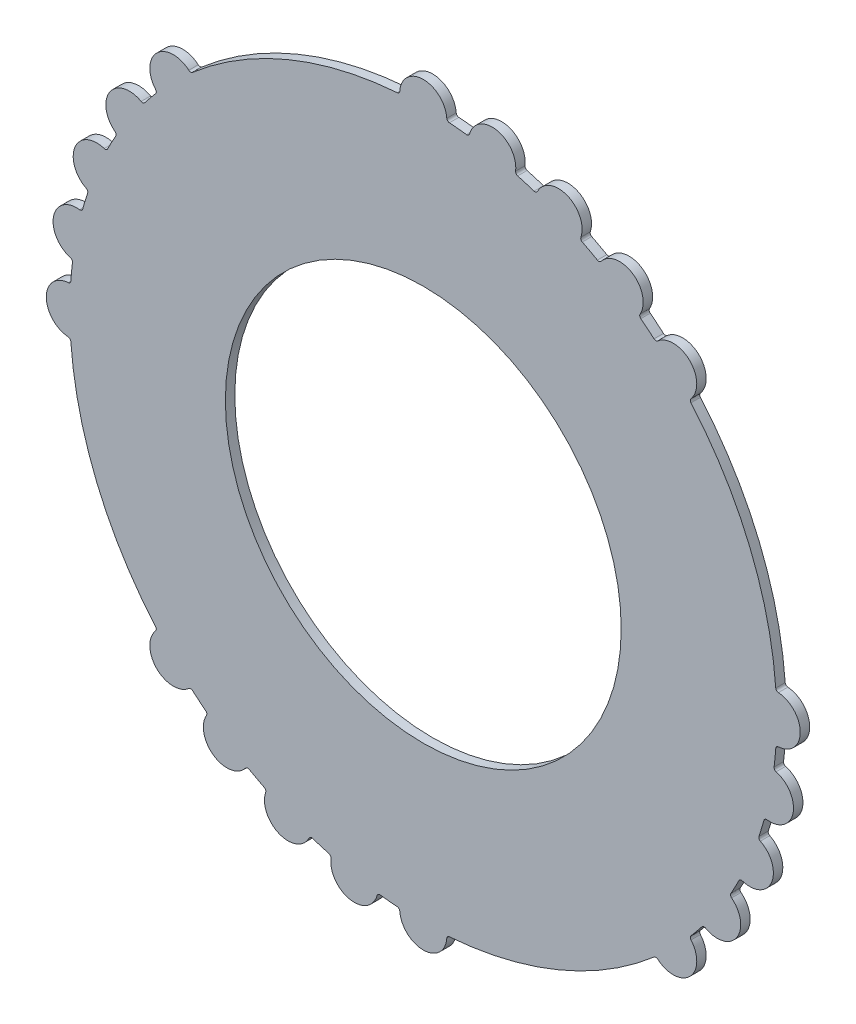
SolidWorks part; units mm, degrees
ref_plane "Plan de face" through (0, 0, 0) normal (0, 0, 1) x (1, 0, 0)
ref_plane "Plan de dessus" through (0, 0, 0) normal (0, 1, 0) x (1, 0, 0)
ref_plane "Plan de droite" through (0, 0, 0) normal (1, 0, 0) x (0, 0, -1)
sketch "Esquisse1" plane through (0, 0, 0) normal (0, 0, 1) x (1, 0, 0)
  line L0 (0, 37.5) -> (0, 0) construction
  line L1 (7.3159, 36.7794) -> (0, 0) construction
  line L2 (14.3506, 34.6455) -> (0, 0) construction
  line L3 (20.8339, 31.1801) -> (0, 0) construction
  line L4 (26.5165, 26.5165) -> (0, 0) construction
  line L5 (31.1801, 20.8339) -> (0, 0) construction
  line L6 (34.6455, 14.3506) -> (0, 0) construction
  line L7 (36.7794, 7.3159) -> (0, 0) construction
  line L8 (37.5, 0) -> (0, 0) construction
  line L9 (36.7794, -7.3159) -> (0, 0) construction
  line L10 (34.6455, -14.3506) -> (0, 0) construction
  line L11 (31.1801, -20.8339) -> (0, 0) construction
  line L12 (26.5165, -26.5165) -> (0, 0) construction
  line L13 (20.8339, -31.1801) -> (0, 0) construction
  line L14 (14.3506, -34.6455) -> (0, 0) construction
  line L15 (7.3159, -36.7794) -> (0, 0) construction
  line L16 (0, -37.5) -> (0, 0) construction
  line L17 (-7.3159, -36.7794) -> (0, 0) construction
  line L18 (-14.3506, -34.6455) -> (0, 0) construction
  line L19 (-20.8339, -31.1801) -> (0, 0) construction
  line L20 (-26.5165, -26.5165) -> (0, 0) construction
  line L21 (-31.1801, -20.8339) -> (0, 0) construction
  line L22 (-34.6455, -14.3506) -> (0, 0) construction
  line L23 (-36.7794, -7.3159) -> (0, 0) construction
  line L24 (-37.5, 0) -> (0, 0) construction
  line L25 (-36.7794, 7.3159) -> (0, 0) construction
  line L26 (-34.6455, 14.3506) -> (0, 0) construction
  line L27 (-31.1801, 20.8339) -> (0, 0) construction
  line L28 (-26.5165, 26.5165) -> (0, 0) construction
  line L29 (-20.8339, 31.1801) -> (0, 0) construction
  line L30 (-14.3506, 34.6455) -> (0, 0) construction
  line L31 (-7.3159, 36.7794) -> (0, 0) construction
  arc A0 (-2.7709, 37.3975) -> (-24.4847, 28.4034) centre (0, 0) ccw
  circle A1 centre (0, 0) radius 21
  arc A2 (2.4938, 37.6756) -> (-2.4938, 37.6756) centre (0, 37.5) ccw
  arc A3 (9.7961, 36.4651) -> (4.9042, 37.4382) centre (7.3159, 36.7794) ccw
  arc A4 (16.7218, 33.8534) -> (12.1138, 35.7621) centre (14.3506, 34.6455) ccw
  arc A5 (23.005, 29.9406) -> (18.8579, 32.7116) centre (20.8339, 31.1801) ccw
  arc A6 (28.4041, 24.8773) -> (24.8773, 28.4041) centre (26.5165, 26.5165) ccw
  arc A7 (32.4893, 18.7041) -> (29.7135, 22.8585) centre (31.1801, 20.8339) ccw
  arc A8 (35.514, 12.0064) -> (33.602, 16.6224) centre (34.6455, 14.3506) ccw
  arc A9 (37.174, 4.8472) -> (36.1992, 9.7476) centre (36.7794, 7.3159) ccw
  arc A10 (37.6756, -2.4938) -> (37.6756, 2.4938) centre (37.5, 0) ccw
  arc A11 (36.4651, -9.7961) -> (37.4382, -4.9042) centre (36.7794, -7.3159) ccw
  arc A12 (33.8534, -16.7218) -> (35.7621, -12.1138) centre (34.6455, -14.3506) ccw
  arc A13 (29.9406, -23.005) -> (32.7116, -18.8579) centre (31.1801, -20.8339) ccw
  arc A14 (24.8773, -28.4041) -> (28.4041, -24.8773) centre (26.5165, -26.5165) ccw
  arc A15 (18.7041, -32.4893) -> (22.8585, -29.7135) centre (20.8339, -31.1801) ccw
  arc A16 (12.0064, -35.514) -> (16.6224, -33.602) centre (14.3506, -34.6455) ccw
  arc A17 (4.8472, -37.174) -> (9.7476, -36.1992) centre (7.3159, -36.7794) ccw
  arc A18 (-2.4938, -37.6756) -> (2.4938, -37.6756) centre (0, -37.5) ccw
  arc A19 (-9.7961, -36.4651) -> (-4.9042, -37.4382) centre (-7.3159, -36.7794) ccw
  arc A20 (-16.7218, -33.8534) -> (-12.1138, -35.7621) centre (-14.3506, -34.6455) ccw
  arc A21 (-23.005, -29.9406) -> (-18.8579, -32.7116) centre (-20.8339, -31.1801) ccw
  arc A22 (-28.4041, -24.8773) -> (-24.8773, -28.4041) centre (-26.5165, -26.5165) ccw
  arc A23 (-32.4893, -18.7041) -> (-29.7135, -22.8585) centre (-31.1801, -20.8339) ccw
  arc A24 (-35.514, -12.0064) -> (-33.602, -16.6224) centre (-34.6455, -14.3506) ccw
  arc A25 (-37.174, -4.8472) -> (-36.1992, -9.7476) centre (-36.7794, -7.3159) ccw
  arc A26 (-37.6756, 2.4938) -> (-37.6756, -2.4938) centre (-37.5, 0) ccw
  arc A27 (-36.4651, 9.7961) -> (-37.4382, 4.9042) centre (-36.7794, 7.3159) ccw
  arc A28 (-33.8534, 16.7218) -> (-35.7621, 12.1138) centre (-34.6455, 14.3506) ccw
  arc A29 (-29.9406, 23.005) -> (-32.7116, 18.8579) centre (-31.1801, 20.8339) ccw
  arc A30 (-24.8773, 28.4041) -> (-28.4041, 24.8773) centre (-26.5165, 26.5165) ccw
  arc A31 (-18.7041, 32.4893) -> (-22.8585, 29.7135) centre (-20.8339, 31.1801) ccw
  arc A32 (-12.0064, 35.514) -> (-16.6224, 33.602) centre (-14.3506, 34.6455) ccw
  arc A33 (-4.8472, 37.174) -> (-9.7476, 36.1992) centre (-7.3159, 36.7794) ccw
  arc A34 (4.5782, 37.2195) -> (2.7709, 37.3975) centre (0, 0) ccw
  arc A35 (11.7514, 35.6112) -> (10.0136, 36.1383) centre (0, 0) ccw
  arc A36 (18.473, 32.6343) -> (16.8714, 33.4904) centre (0, 0) ccw
  arc A37 (24.4847, 28.4034) -> (23.0809, 29.5554) centre (0, 0) ccw
  arc A38 (-28.4034, 24.4847) -> (-29.5554, 23.0809) centre (0, 0) ccw
  arc A39 (-32.6343, 18.473) -> (-33.4904, 16.8714) centre (0, 0) ccw
  arc A40 (-35.6112, 11.7514) -> (-36.1383, 10.0136) centre (0, 0) ccw
  arc A41 (-37.2195, 4.5782) -> (-37.3975, 2.7709) centre (0, 0) ccw
  arc A42 (-37.3975, -2.7709) -> (-28.4034, -24.4847) centre (0, 0) ccw
  arc A43 (-24.4847, -28.4034) -> (-23.0809, -29.5554) centre (0, 0) ccw
  arc A44 (-18.473, -32.6343) -> (-16.8714, -33.4904) centre (0, 0) ccw
  arc A45 (-11.7514, -35.6112) -> (-10.0136, -36.1383) centre (0, 0) ccw
  arc A46 (-4.5782, -37.2195) -> (-2.7709, -37.3975) centre (0, 0) ccw
  arc A47 (2.7709, -37.3975) -> (24.4847, -28.4034) centre (0, 0) ccw
  arc A48 (28.4034, -24.4847) -> (29.5554, -23.0809) centre (0, 0) ccw
  arc A49 (32.6343, -18.473) -> (33.4904, -16.8714) centre (0, 0) ccw
  arc A50 (35.6112, -11.7514) -> (36.1383, -10.0136) centre (0, 0) ccw
  arc A51 (37.2195, -4.5782) -> (37.3975, -2.7709) centre (0, 0) ccw
  arc A52 (37.3975, 2.7709) -> (28.4034, 24.4847) centre (0, 0) ccw
  arc A53 (-2.4938, 37.6756) -> (-2.7709, 37.3975) centre (-2.7931, 37.6967) cw
  arc A54 (2.4938, 37.6756) -> (2.7709, 37.3975) centre (2.7931, 37.6967) ccw
  arc A55 (4.9042, 37.4382) -> (4.5782, 37.2195) centre (4.6148, 37.5172) cw
  arc A56 (9.7961, 36.4651) -> (10.0136, 36.1383) centre (10.0937, 36.4274) ccw
  arc A57 (12.1138, 35.7621) -> (11.7514, 35.6112) centre (11.8454, 35.896) cw
  arc A58 (16.7218, 33.8534) -> (16.8714, 33.4904) centre (17.0064, 33.7583) ccw
  arc A59 (18.8579, 32.7116) -> (18.473, 32.6343) centre (18.6208, 32.8954) cw
  arc A60 (23.005, 29.9406) -> (23.0809, 29.5554) centre (23.2655, 29.7919) ccw
  arc A61 (24.8773, 28.4041) -> (24.4847, 28.4034) centre (24.6806, 28.6306) cw
  arc A62 (28.4041, 24.8773) -> (28.4034, 24.4847) centre (28.6306, 24.6806) ccw
  arc A63 (37.6756, 2.4938) -> (37.3975, 2.7709) centre (37.6967, 2.7931) cw
  arc A64 (37.6756, -2.4938) -> (37.3975, -2.7709) centre (37.6967, -2.7931) ccw
  arc A65 (37.4382, -4.9042) -> (37.2195, -4.5782) centre (37.5172, -4.6148) cw
  arc A66 (36.4651, -9.7961) -> (36.1383, -10.0136) centre (36.4274, -10.0937) ccw
  arc A67 (35.7621, -12.1138) -> (35.6112, -11.7514) centre (35.896, -11.8454) cw
  arc A68 (33.8534, -16.7218) -> (33.4904, -16.8714) centre (33.7583, -17.0064) ccw
  arc A69 (32.7116, -18.8579) -> (32.6343, -18.473) centre (32.8954, -18.6208) cw
  arc A70 (29.9406, -23.005) -> (29.5554, -23.0809) centre (29.7919, -23.2655) ccw
  arc A71 (28.4041, -24.8773) -> (28.4034, -24.4847) centre (28.6306, -24.6806) cw
  arc A72 (24.8773, -28.4041) -> (24.4847, -28.4034) centre (24.6806, -28.6306) ccw
  arc A73 (2.4938, -37.6756) -> (2.7709, -37.3975) centre (2.7931, -37.6967) cw
  arc A74 (-2.4938, -37.6756) -> (-2.7709, -37.3975) centre (-2.7931, -37.6967) ccw
  arc A75 (-4.9042, -37.4382) -> (-4.5782, -37.2195) centre (-4.6148, -37.5172) cw
  arc A76 (-9.7961, -36.4651) -> (-10.0136, -36.1383) centre (-10.0937, -36.4274) ccw
  arc A77 (-12.1138, -35.7621) -> (-11.7514, -35.6112) centre (-11.8454, -35.896) cw
  arc A78 (-16.7218, -33.8534) -> (-16.8714, -33.4904) centre (-17.0064, -33.7583) ccw
  arc A79 (-18.8579, -32.7116) -> (-18.473, -32.6343) centre (-18.6208, -32.8954) cw
  arc A80 (-23.005, -29.9406) -> (-23.0809, -29.5554) centre (-23.2655, -29.7919) ccw
  arc A81 (-24.8773, -28.4041) -> (-24.4847, -28.4034) centre (-24.6806, -28.6306) cw
  arc A82 (-28.4041, -24.8773) -> (-28.4034, -24.4847) centre (-28.6306, -24.6806) ccw
  arc A83 (-37.6756, -2.4938) -> (-37.3975, -2.7709) centre (-37.6967, -2.7931) cw
  arc A84 (-37.6756, 2.4938) -> (-37.3975, 2.7709) centre (-37.6967, 2.7931) ccw
  arc A85 (-37.4382, 4.9042) -> (-37.2195, 4.5782) centre (-37.5172, 4.6148) cw
  arc A86 (-36.4651, 9.7961) -> (-36.1383, 10.0136) centre (-36.4274, 10.0937) ccw
  arc A87 (-35.7621, 12.1138) -> (-35.6112, 11.7514) centre (-35.896, 11.8454) cw
  arc A88 (-33.8534, 16.7218) -> (-33.4904, 16.8714) centre (-33.7583, 17.0064) ccw
  arc A89 (-32.7116, 18.8579) -> (-32.6343, 18.473) centre (-32.8954, 18.6208) cw
  arc A90 (-29.9406, 23.005) -> (-29.5554, 23.0809) centre (-29.7919, 23.2655) ccw
  arc A91 (-28.4041, 24.8773) -> (-28.4034, 24.4847) centre (-28.6306, 24.6806) cw
  arc A92 (-24.8773, 28.4041) -> (-24.4847, 28.4034) centre (-24.6806, 28.6306) ccw
  dimension "D1" = 2.5
  dimension "D2" = 37.5
  dimension "D3" = 42
  dimension "D4" = 0.3
  dimension "D5" = 11.25
  dimension "D6" = 45
  dimension "D7" = 11.25
  dimension "D8" = 11.25
  dimension "D9" = 11.25
  dimension "D10" = 11.25
  dimension "D11" = 11.25
  dimension "D12" = 11.25
  dimension "D13" = 11.25
  dimension "D14" = 45
extrude "Extrusion1" add sketch "Esquisse1" along normal mid plane 1
